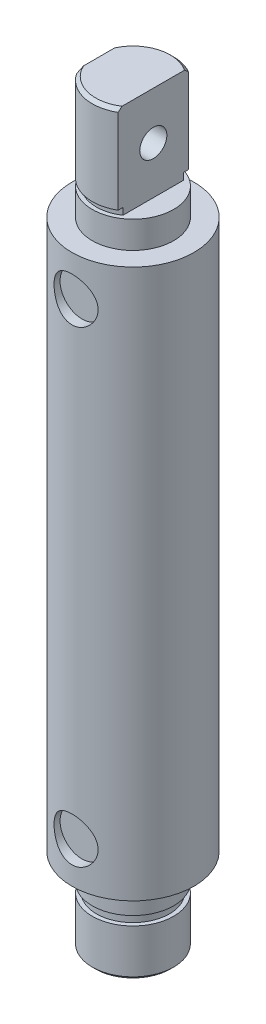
SolidWorks part; units mm, degrees
ref_plane "Front" through (0, 0, 0) normal (0, 0, 1) x (1, 0, 0)
ref_plane "Top" through (0, 0, 0) normal (0, 1, 0) x (1, 0, 0)
ref_plane "Right" through (0, 0, 0) normal (1, 0, 0) x (0, 0, -1)
sketch "Sketch1" plane through (0, 0, 0) normal (0, 1, 0) x (1, 0, 0)
  circle A0 centre (0, 0) radius 14.2875
  dimension "OD" = 28.575
extrude "CylinderBody" add sketch "Sketch1" along normal blind 128.5875
sketch "Sketch2" plane through (0, 128.5875, 0) normal (0, 1, 0) x (-1, 0, 0)
  circle A0 centre (0, 0) radius 9.525
  dimension "D1" = 19.05
extrude "Boss1" add sketch "Sketch2" along normal blind 6.35
sketch "Sketch3" plane through (0, 0, 0) normal (0, -1, 0) x (1, 0, 0)
  circle A0 centre (0, 0) radius 9.525
  dimension "D1" = 19.05
extrude "Boss2" add sketch "Sketch3" along normal blind 6.35
sketch "Sketch4" plane through (0, 134.9375, 0) normal (0, 1, 0) x (-1, 0, 0)
  line L0 (0, 0) -> (0, -4.5344) construction
  line L1 (-4.7625, -8.2489) -> (-4.7625, 8.2489)
  line L2 (7.9375, -5.2651) -> (7.9375, 5.2651)
  circle A0 centre (0, 0) radius 9.525 construction
  arc A1 (7.9375, 5.2651) -> (-4.7625, 8.2489) centre (0, 0) ccw
  arc A2 (-4.7625, -8.2489) -> (7.9375, -5.2651) centre (0, 0) ccw
  dimension "D1" = 4.7625
  dimension "D2" = 7.9375
extrude "Thrd.Tang" add sketch "Sketch4" along normal blind 22.225
sketch "Sketch5" plane through (0, 0, 0) normal (1, 0, 0) x (0, 0, -1)
  line L0 (8.2489, 134.9375) -> (-8.2489, 134.9375) construction
  line L1 (9.525, 128.5875) -> (9.525, 157.1625) construction
  line L2 (8.5598, 134.9375) -> (9.525, 134.9375)
  line L3 (9.525, 134.9375) -> (9.525, 136.525)
  line L4 (9.525, 136.525) -> (8.5598, 136.525)
  line L5 (8.5598, 136.525) -> (8.5598, 134.9375)
  line L6 (0, 0) -> (0, 248.7988) construction
  line L7 (0, 157.1625) -> (0, 134.9375) construction
  dimension "D1" = 8.5598
  dimension "D2" = 1.5875
revolve "Cut-Revolve1" cut sketch "Sketch5" angle 360 about L6
sketch "Sketch6" plane through (0, -6.35, 0) normal (0, -1, 0) x (1, 0, 0)
  circle A3 centre (0, 0) radius 8.5598
  circle A4 centre (0, 0) radius 8.5598
  dimension "D1" = 0.9652
extrude "thrd-relief" add sketch "Sketch6" along normal blind 2.1082
sketch "Sketch7" plane through (0, -8.4582, 0) normal (0, -1, 0) x (1, 0, 0)
  circle A0 centre (0, 0) radius 9.525 construction
  circle A1 centre (0, 0) radius 9.525
extrude "Rod-Boss" add sketch "Sketch7" along normal blind 11.1125
chamfer "Chamfer1" distance 0.7874 angle 45 7 edges at (-2.1785, 157.1625, -9.2725) (-2.1785, 157.1625, 9.2725) (0, -19.5707, -9.525)
sketch "Sketch8" plane through (-7.9375, 0, 0) normal (-1, 0, 0) x (0, 0, 1)
  line L0 (0, 156.3751) -> (0, 136.525) construction
  line L1 (14.2875, 128.5875) -> (-14.2875, 128.5875) construction
  circle A0 centre (0, 146.05) radius 3.175
  dimension "D1" = 6.35
  dimension "D2" = 17.4625
extrude "1/4Hole" cut sketch "Sketch8" against normal through all
ref_plane "Plane7.8" through (0, 0, 14.2875) normal (0, 0, 1) x (1, 0, 0)
ref_plane "Plane1-1.8" through (0, 0, 17.4625) normal (0, 0, 1) x (1, 0, 0)
ref_plane "Plane2-1.5" through (0, 0, 34.925) normal (0, 0, 1) x (1, 0, 0)
sketch "Sketch9" plane through (0, 0, 14.2875) normal (0, 0, 1) x (1, 0, 0)
  line L0 (0, 0) -> (0, -30.7206) construction
  line L1 (0, 156.3751) -> (0, 136.525) construction
  line L2 (14.2875, 128.5875) -> (-14.2875, 128.5875) construction
  line L3 (-14.2875, 0) -> (14.2875, 0) construction
  circle A0 centre (0, 9.525) radius 5.1587
  circle A1 centre (0, 119.0625) radius 5.1587
  dimension "D1" = 10.3175
  dimension "D2" = 10.3175
  dimension "D3" = 9.525
  dimension "D4" = 9.525
extrude "Port" cut sketch "Sketch9" against normal blind 2.3622
